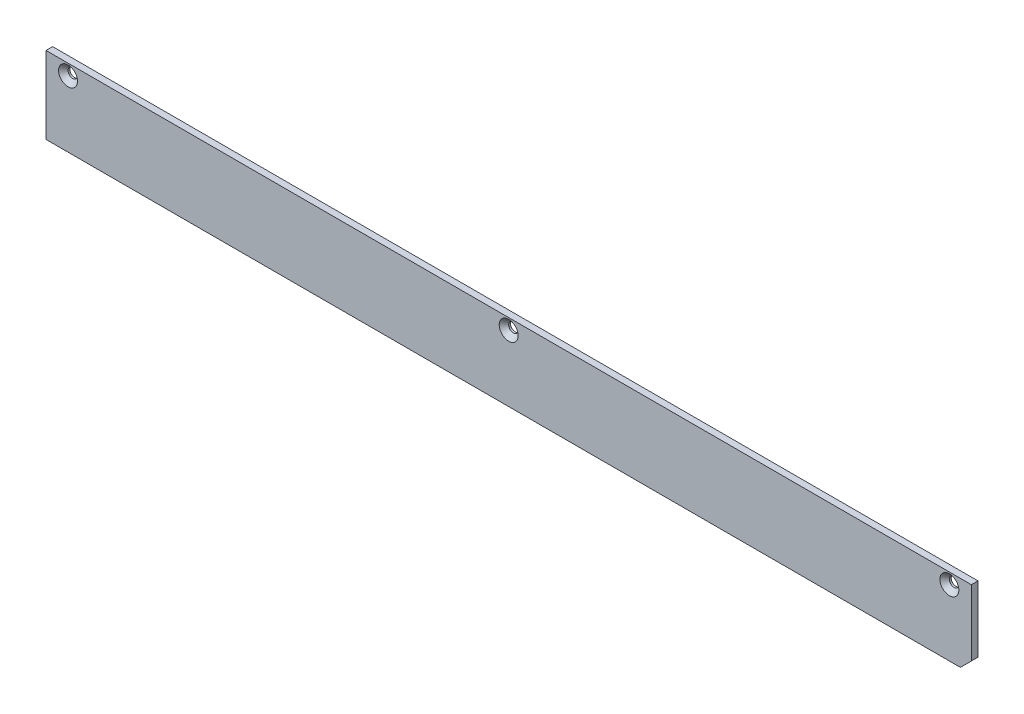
SolidWorks part; units mm, degrees
ref_plane "Спереди" through (0, 0, 0) normal (0, 0, 1) x (1, 0, 0)
ref_plane "Сверху" through (0, 0, 0) normal (0, 1, 0) x (1, 0, 0)
ref_plane "Справа" through (0, 0, 0) normal (1, 0, 0) x (0, 0, -1)
sketch "Эскиз1" plane through (0, 0, 0) normal (0, 0, 1) x (1, 0, 0)
  line L1 (0, 0) -> (420, 0)
  line L2 (0, 0) -> (0, 35)
  line L3 (0, 35) -> (420, 35)
  line L4 (420, 0) -> (420, 35)
  dimension "D1" = 35
  dimension "D2" = 420
extrude "Бобышка-Вытянуть1" add sketch "Эскиз1" along normal blind 3
sketch "Эскиз2" plane through (0, 0, 3) normal (0, 0, 1) x (1, 0, 0)
  line L0 (420, 35) -> (0, 35) construction
  line L1 (0, 35) -> (0, 0) construction
  circle A0 centre (10, 30) radius 4.3
  circle A1 centre (210, 30) radius 4.3
  circle A2 centre (410, 30) radius 4.3
  dimension "D1" = 8.6
  dimension "D2" = 8.6
  dimension "D3" = 8.6
  dimension "D4" = 5
  dimension "D5" = 10
  dimension "D6" = 5
  dimension "D7" = 5
  dimension "D8" = 200
  dimension "D9" = 200
extrude "Вырез-Вытянуть1" cut sketch "Эскиз2" against normal blind 2.15
draft "Уклон1" type of draft neutral plane draft angle 45 faces to draft 1 parameters "D1"=45
draft "Уклон2" type of draft neutral plane draft angle 45 faces to draft 1 parameters "D1"=45
draft "Уклон3" type of draft neutral plane draft angle 45 faces to draft 1 parameters "D1"=45
sketch "Эскиз3" plane through (0, 0, 0.85) normal (0, 0, 1) x (1, 0, 0)
  circle A0 centre (10, 30) radius 2.15
  dimension "D1" = 4.3
extrude "Вырез-Вытянуть2" cut sketch "Эскиз3" against normal through all
sketch "Эскиз4" plane through (0, 0, 0.85) normal (0, 0, 1) x (1, 0, 0)
  circle A0 centre (210, 30) radius 2.15
  dimension "D1" = 4.3
extrude "Вырез-Вытянуть3" cut sketch "Эскиз4" against normal through all
sketch "Эскиз5" plane through (0, 0, 0.85) normal (0, 0, 1) x (1, 0, 0)
  circle A0 centre (410, 30) radius 2.15
  dimension "D1" = 4.3
extrude "Вырез-Вытянуть4" cut sketch "Эскиз5" against normal through all
chamfer "Фаска1" distance 5 angle 45 1 edges at (420, 0, 1.5)
